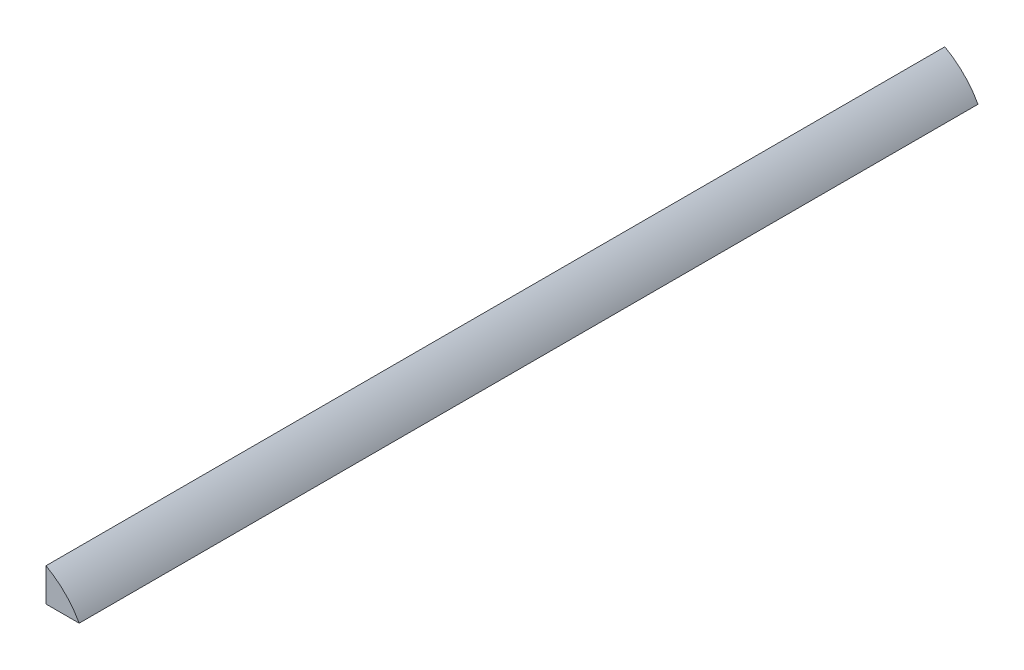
SolidWorks part; units mm, degrees
other "DetailItem1"
ref_plane "Front" through (0, 0, 0) normal (0, 0, 1) x (1, 0, 0)
ref_plane "Top" through (0, 0, 0) normal (0, 1, 0) x (1, 0, 0)
ref_plane "Right" through (0, 0, 0) normal (1, 0, 0) x (0, 0, -1)
other "Weld Bead1"
